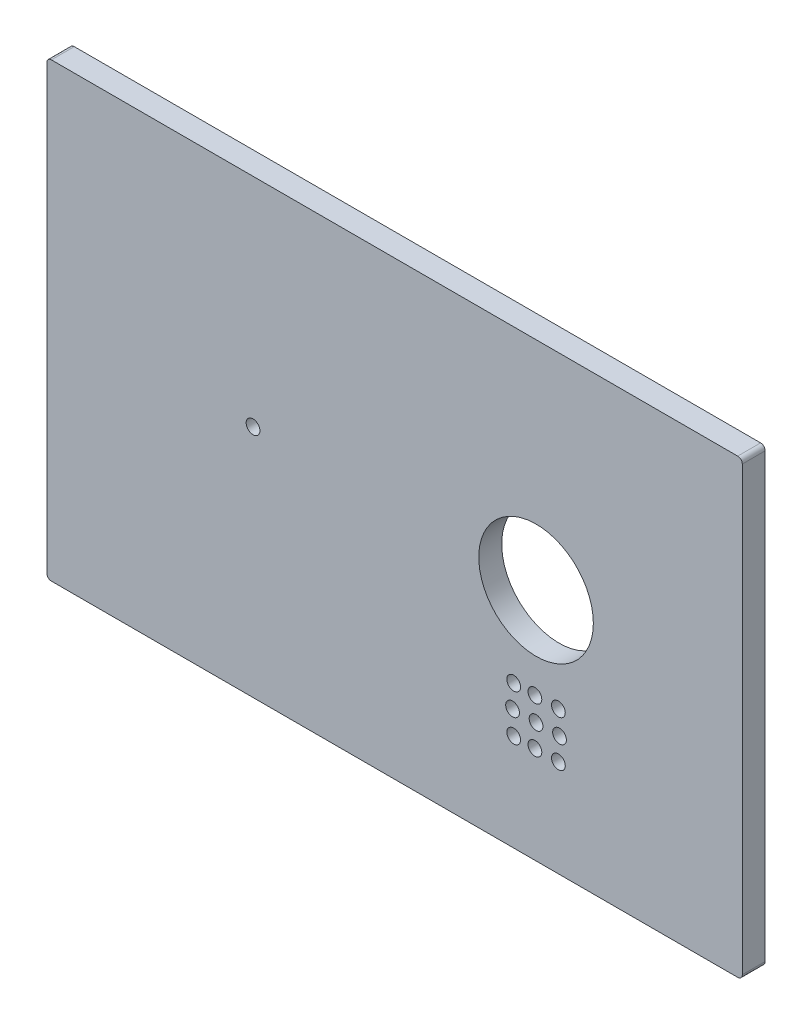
SolidWorks part; units mm, degrees
ref_plane "Plan de face" through (0, 0, 0) normal (0, 0, 1) x (1, 0, 0)
ref_plane "Plan de dessus" through (0, 0, 0) normal (0, 1, 0) x (1, 0, 0)
ref_plane "Plan de droite" through (0, 0, 0) normal (1, 0, 0) x (0, 0, -1)
sketch "Esquisse1" plane through (0, 0, 0) normal (0, 0, 1) x (1, 0, 0)
  line L0 (0, 265.9993) -> (0, -156.1765) construction
  line L1 (-170.75, 0) -> (0, 0) construction
  line L2 (151.75, 74.6881) -> (151.75, 190.3119)
  line L3 (-149.75, 246) -> (150.25, 246) construction
  line L4 (-166.8769, 226) -> (192.5225, 226) construction
  line L5 (-202.1318, 19) -> (247.1432, 19) construction
  line L6 (151.75, 226) -> (151.75, -75.5923) construction
  line L7 (-149.75, 226) -> (149.75, 226)
  line L8 (-151.75, 74.6881) -> (-151.75, 190.3119)
  line L9 (-186.4359, 29) -> (178.2698, 29) construction
  line L11 (-149.75, 29) -> (149.75, 29)
  line L16 (151.75, 224) -> (151.75, 190.3119)
  line L19 (151.75, 74.6881) -> (151.75, 31)
  line L25 (-151.75, 74.6881) -> (-151.75, 31)
  line L26 (-151.75, 224) -> (-151.75, 190.3119)
  arc A0 (149.75, 29) -> (151.75, 31) centre (149.75, 31) ccw
  arc A1 (-149.75, 29) -> (-151.75, 31) centre (-149.75, 31) cw
  arc A2 (-149.75, 226) -> (-151.75, 224) centre (-149.75, 224) ccw
  arc A3 (149.75, 226) -> (151.75, 224) centre (149.75, 224) cw
  point P3 (-151.75, 19)
  point P11 (151.75, 29)
  point P14 (151.75, 19)
  point P16 (-151.75, 29)
  point P19 (151.75, 246)
  point P20 (-151.75, 226)
  point P24 (-151.75, 246)
  point P47 (0, 19)
  dimension "D1" = 2
  dimension "D5" = 2
  dimension "D2" = 246
  dimension "D3" = 10
  dimension "D4" = 20
  dimension "D6" = 303.5
extrude "Boss.-Extru.1" add sketch "Esquisse1" along normal blind 10
sketch "Esquisse2" plane through (0, 0, 10) normal (0, 0, 1) x (1, 0, 0)
  line L0 (61.75, 255.5409) -> (61.75, 13.7058) construction
  line L1 (-122.6524, 131.3272) -> (121.9585, 131.3272) construction
  line L2 (151.75, 31) -> (151.75, 224) construction
  line L3 (-61.75, 255.5409) -> (-61.75, 82.752) construction
  line L4 (-151.75, 224) -> (-151.75, 31) construction
  line L5 (0, 81.3272) -> (121.9585, 81.3272) construction
  circle A0 centre (61.75, 131.3272) radius 14.1
  circle A1 centre (-61.75, 131.3272) radius 3
  circle A2 centre (61.75, 81.3272) radius 3
  circle A3 centre (72, 81.3272) radius 3
  circle A5 centre (61.25, 91.3272) radius 3
  circle A6 centre (71.5, 91.3272) radius 3
  circle A8 centre (52, 91.3272) radius 3
  circle A9 centre (51.5, 81.3272) radius 3
  circle A13 centre (71.5, 71.3272) radius 3
  circle A14 centre (52, 71.3272) radius 3
  circle A16 centre (61.25, 71.3272) radius 3
  circle A17 centre (81.75, 91.3272) radius 3
  circle A18 centre (82.25, 81.3272) radius 3
  dimension "D3" = 50
  dimension "D4" = 3
  dimension "D1" = 90
  dimension "D2" = 90
  dimension "D5" = 2
extrude "Enlèv. mat.-Extru.1" cut sketch "Esquisse2" against normal through all
sketch "Esquisse3" plane through (0, 0, 10) normal (0, 0, 1) x (1, 0, 0)
  circle A0 centre (61.75, 131.3272) radius 25
extrude "Enlèv. mat.-Extru.2" cut sketch "Esquisse3" against normal through all
